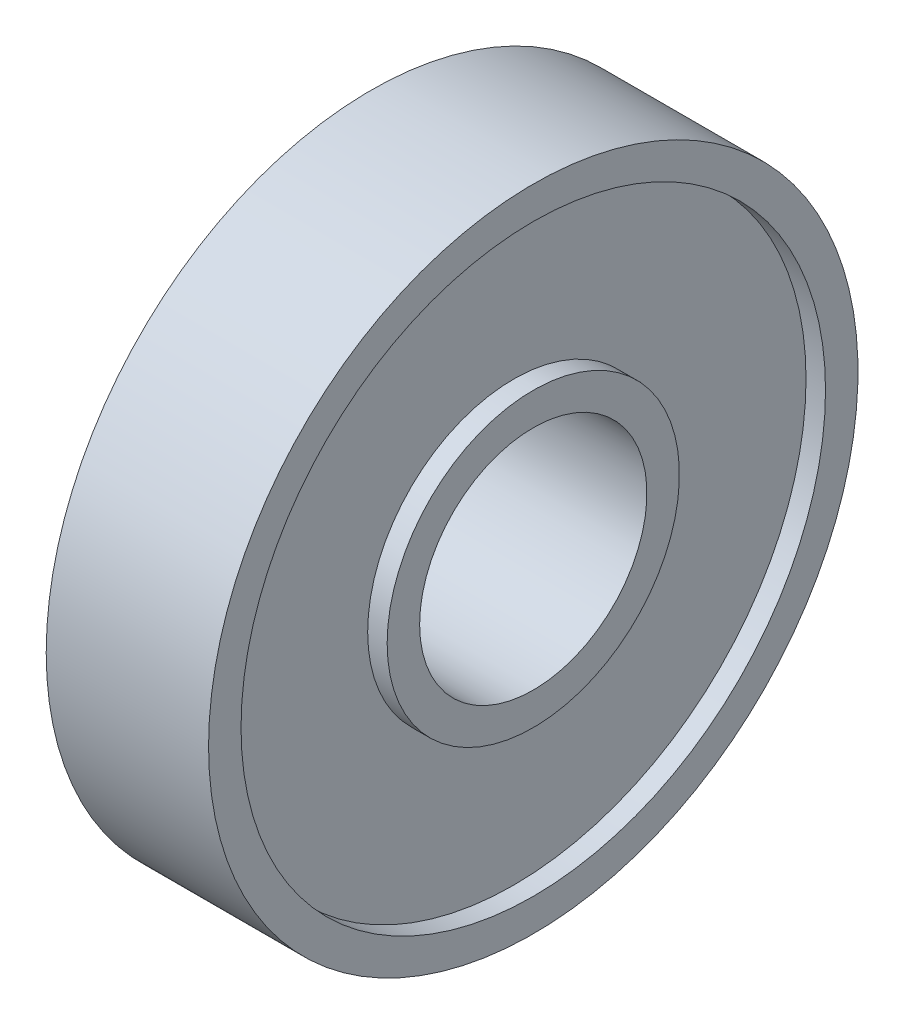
SolidWorks part; units mm, degrees
ref_plane "Plan1" through (0, 0, 0) normal (0, 0, 1) x (1, 0, 0)
ref_plane "Plan2" through (0, 0, 0) normal (0, 1, 0) x (1, 0, 0)
ref_plane "Plan3" through (0, 0, 0) normal (1, 0, 0) x (0, 0, -1)
sketch "Esquisse1" plane through (0, 0, 0) normal (0, 0, 1) x (1, 0, 0)
  line L0 (0, 50) -> (0, 45)
  line L1 (0, 50) -> (25, 50)
  line L2 (0, 45) -> (3, 45)
  line L3 (0, 22.5) -> (3, 22.5)
  line L4 (0, 17.5) -> (25, 17.5)
  line L5 (25, 50) -> (25, 45)
  line L6 (3, 45) -> (3, 22.5)
  line L7 (22, 45) -> (22, 22.5)
  line L8 (0, 22.5) -> (0, 17.5)
  line L9 (22, 45) -> (25, 45)
  line L10 (22, 22.5) -> (25, 22.5)
  line L11 (25, 22.5) -> (25, 17.5)
  line L12 (-3.7953, 0) -> (36.0906, 0) construction
  dimension "D1" = 25
  dimension "D2" = 3
  dimension "D3" = 3
  dimension "D4" = 50
  dimension "D5" = 17.5
  dimension "D6" = 22.5
  dimension "D7" = 45
revolve "Base-Révolution" add sketch "Esquisse1" angle 360 about L12
